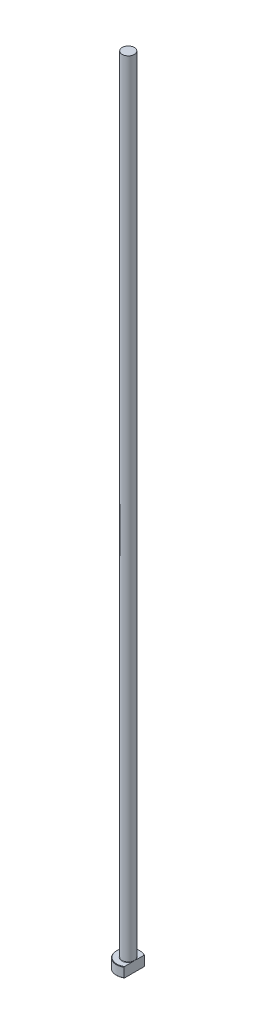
SolidWorks part; units mm, degrees
ref_plane "Front Plane" through (0, 0, 0) normal (0, 0, 1) x (1, 0, 0)
ref_plane "Top Plane" through (0, 0, 0) normal (0, 1, 0) x (1, 0, 0)
ref_plane "Right Plane" through (0, 0, 0) normal (1, 0, 0) x (0, 0, -1)
sketch "Sketch1" plane through (0, 0, 0) normal (0, 0, 1) x (1, 0, 0)
  line L0 (0, 259.9588) -> (0, -15.1925) construction
  line L1 (0, 0) -> (-6, 0)
  line L2 (-6, 0) -> (-6, 5)
  line L3 (-6, 5) -> (-3.05, 5)
  line L4 (-3.05, 5) -> (-3.05, 400)
  line L5 (-3.05, 400) -> (0, 400)
  line L6 (0, 400) -> (0, 0)
  dimension "L" = 400
  dimension "H" = 12
  dimension "T" = 5
  dimension "D" = 6.1
revolve "Revolve1" add sketch "Sketch1" angle 360 about L0
chamfer "Chamfer1" distance 0.2 angle 45 2 edges at (0, 5, 6) (0, 0, 6)
fillet "Fillet1" radius 0.2 1 edges at (0, 5, 3.05)
sketch "Sketch2" plane through (0, 0, 0) normal (0, 1, 0) x (1, 0, 0)
  line L0 (3.05, 5.167) -> (3.05, -5.167)
  circle A0 centre (0, 0) radius 6 construction
  arc A1 (3.05, -5.167) -> (3.05, 5.167) centre (0, 0) ccw
  circle A2 centre (0, 0) radius 3.05 construction
extrude "KEY" cut sketch "Sketch2" along normal through all
